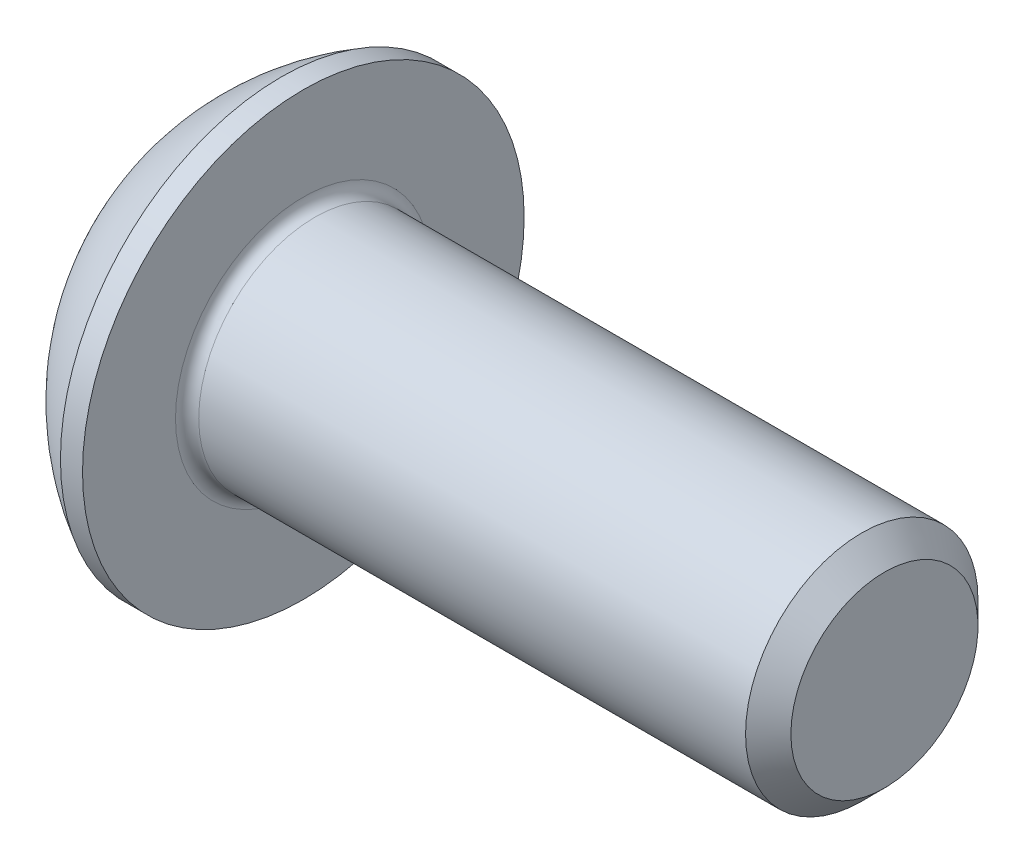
SolidWorks part; units mm, degrees
ref_plane "Plane1" through (0, 0, 0) normal (0, 0, 1) x (1, 0, 0)
ref_plane "Plane2" through (0, 0, 0) normal (0, 1, 0) x (1, 0, 0)
ref_plane "Plane3" through (0, 0, 0) normal (1, 0, 0) x (0, 0, -1)
sketch "BodySke" plane through (0, 0, 0) normal (0, 0, 1) x (1, 0, 0)
  line L0 (12.2, 0) -> (12.2, 1.61)
  line L1 (11.81, 2) -> (2.2, 2)
  line L2 (2.2, 2) -> (2.2, 3.8)
  line L3 (2.2, 3.8) -> (1.82, 3.8)
  line L4 (0, 0) -> (101.6, 0) construction
  line L5 (2.2, -3.8) -> (1.82, -3.8) construction
  line L6 (55.6768, -2) -> (2.2, -2) construction
  line L7 (12.2, 0) -> (0, 0)
  line L8 (0, 1.9) -> (0, -1.9) construction
  line L9 (0, 0) -> (0, 1.9)
  line L10 (12.2, 1.61) -> (11.81, 2)
  line L11 (12.2, -1.61) -> (11.81, -2) construction
  line L12 (2.9, 9.525) -> (2.9, -2) construction
  line L13 (2.2, 9.525) -> (2.2, -2) construction
  arc A1 (0, 1.9) -> (1.82, 3.8) centre (3.8853, 0) cw
  dimension "D1" = 3.8
  dimension "Diameter" = 4
  dimension "Length" = 10
  dimension "Head_dia" = 7.6
  dimension "Head_ht" = 2.2
  dimension "Head_side_ht" = 0.38
  dimension "Minor_dia" = 3.22
  dimension "Body_ch_ang" = 45
  dimension "Advance" = 0.7
  dimension "Thread_nom" = 10
revolve "BaseBody" add sketch "BodySke" angle 360 about L4
fillet "Fillet1" radius 0.2 1 edges at (2.2, 0, 2)
sketch "Sketch2" plane through (0, 0, 0) normal (0, 0, 1) x (1, 0, 0)
  line L0 (0, 1.25) -> (1.3, 1.25)
  line L1 (1.3, 1.25) -> (2.0217, 0)
  line L3 (2.0217, 0) -> (0, 0)
  line L4 (0, 0) -> (0, 1.25)
  line L5 (0, -1.25) -> (1.3, -1.25) construction
  line L6 (0, 0) -> (47.625, 0) construction
  dimension "D2" = 60
  dimension "PreBroach_depth" = 1.3
  dimension "PreBroach_dia" = 2.5
revolve "PreBroach" cut sketch "Sketch2" angle 360 about L6
sketch "Sketch3" plane through (0, 0, 0) normal (1, 0, 0) x (0, 0, -1)
  line L0 (-1.25, -0.7217) -> (-1.25, 0.7217)
  line L1 (-1.25, 0.7217) -> (0, 1.4434)
  line L2 (0, 1.4434) -> (1.25, 0.7217)
  line L3 (1.25, 0.7217) -> (1.25, -0.7217)
  line L4 (1.25, -0.7217) -> (0, -1.4434)
  line L5 (0, -1.4434) -> (-1.25, -0.7217)
  dimension "D1" = 1.25
  dimension "D2" = 1.25
  dimension "D3" = 2.5
  dimension "Hex_size" = 2.5
extrude "Hex" cut sketch "Sketch3" along normal blind 1.3
sketch "ThdSchSke" plane through (0, 0, 0) normal (0, 0, 1) x (1, 0, 0)
  line L0 (3.6, -1.61) -> (3.3269, -2)
  line L1 (3.6, -1.61) -> (3.8731, -2)
  line L2 (3.8731, -2) -> (3.8731, -2.5)
  line L3 (-3.175, 0) -> (5.1513, 0) construction
  line L5 (3.8731, -2.5) -> (3.3269, -2.5)
  line L6 (3.3269, -2.5) -> (3.3269, -2)
  dimension "Thread_minor" = 3.22
  dimension "Diameter" = 4
  dimension "Start" = 3.6
  dimension "SideAngle" = 55
  dimension "VeeAngle" = 70
  dimension "Overcut" = 5
revolve "ThreadSchematic" [suppressed] cut sketch "ThdSchSke" angle 360 about L3
pattern_linear "ThdSchPat" [suppressed]
equation "\"D1@BodySke\" = \"Head_dia@BodySke\" * .5"
equation "\"Thread_minor@ThreadCosmetic\" = \"Minor_dia@BodySke\""
equation "\"D1@Sketch3\" = \"Hex_size@Sketch3\" / 2"
equation "\"D2@Sketch3\" = \"D1@Sketch3\""
equation "\"D3@Sketch3\" = \"Hex_size@Sketch3\""
equation "\"Thread_length@ThreadCosmetic\" = ((sgn( (\"Length@BodySke\" - \"Advance@BodySke\" * 2.0) - \"Thread_nom@BodySke\" )-1)*( (\"Length@BodySke\" - \"Advance@BodySke\" * 2.0) - \"Thread_nom@BodySke\" ))/-2+ \"Thread_no"
equation "\"Thread_minor@ThdSchSke\" = \"Minor_dia@BodySke\""
equation "\"Diameter@ThdSchSke\" = \"Diameter@BodySke\""
equation "\"Overcut@ThdSchSke\" = \"Diameter@BodySke\" * 1.25"
equation "\"Start@ThdSchSke\" = \"Head_ht@BodySke\" + \"Length@BodySke\" - \"Thread_length@ThreadCosmetic\"  '---Non-countersunk---"
equation "\"Num_threads@ThdSchPat\" = int( \"Thread_length@ThreadCosmetic\" / \"Advance@BodySke\" + 0.999 )  + 1"
equation "\"Advance@ThdSchPat\" = \"Thread_length@ThreadCosmetic\" /  (\"Num_threads@ThdSchPat\" - 1) 'relax it"
equation "\"Num_threads@ThdSchPat\" = \"Num_threads@ThdSchPat\" - sgn( \"Num_threads@ThdSchPat\" - 1) '---chamfered tips only---"
